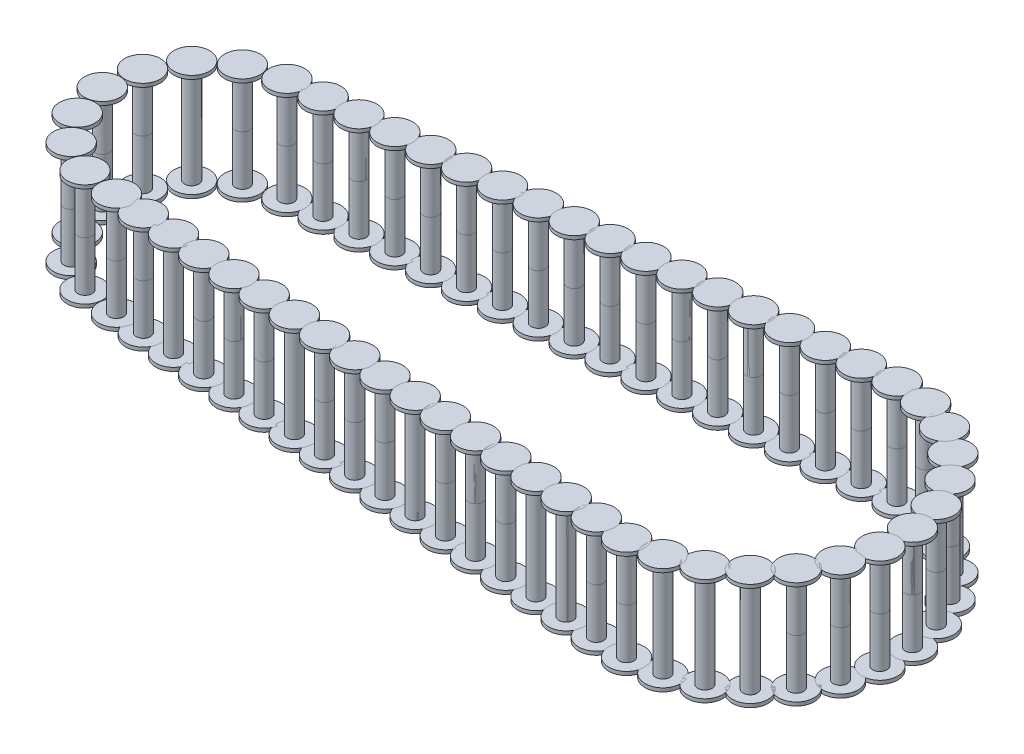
SolidWorks part; units mm, degrees
ref_plane "Front" through (0, 0, 0) normal (0, 0, 1) x (1, 0, 0)
ref_plane "Top" through (0, 0, 0) normal (0, 1, 0) x (1, 0, 0)
ref_plane "Right" through (0, 0, 0) normal (1, 0, 0) x (0, 0, -1)
sketch "Sketch1" plane through (0, 0, 0) normal (0, 1, 0) x (1, 0, 0)
  line L0 (-0.4575, -5.9825) -> (38.6537, -8.9738) construction
  line L1 (-0.4575, 5.9825) -> (38.6537, 8.9738) construction
  line L2 (-0.4957, 6.4811) -> (38.6155, 9.4723) construction
  line L3 (-0.4957, -6.4811) -> (38.6155, -9.4723) construction
  arc A0 (38.6537, -8.9738) -> (38.6537, 8.9738) centre (39.34, 0) ccw construction
  arc A1 (-0.4575, 5.9825) -> (-0.4575, -5.9825) centre (0, 0) ccw construction
  arc A2 (38.6155, -9.4723) -> (38.6155, 9.4723) centre (39.34, 0) ccw construction
  arc A3 (-0.4957, 6.4811) -> (-0.4957, -6.4811) centre (0, 0) ccw construction
  circle A4 centre (39.34, 9.5) radius 0.5
  circle A5 centre (-0.4957, 6.4811) radius 0.5
  circle A6 centre (-2.9381, 5.798) radius 0.5
  circle A7 centre (-4.9333, 4.2323) radius 0.5
  circle A8 centre (-6.1774, 2.0223) radius 0.5
  circle A9 centre (-6.4811, -0.4957) radius 0.5
  circle A10 centre (-5.798, -2.9381) radius 0.5
  circle A11 centre (-4.2323, -4.9333) radius 0.5
  circle A12 centre (-2.0223, -6.1774) radius 0.5
  circle A13 centre (0.4957, -6.4811) radius 0.5
  circle A14 centre (41.6135, 9.2239) radius 0.5
  circle A15 centre (43.7549, 8.4118) radius 0.5
  circle A16 centre (45.6397, 7.1109) radius 0.5
  circle A17 centre (47.1583, 5.3966) radius 0.5
  circle A18 centre (48.2227, 3.3687) radius 0.5
  circle A19 centre (48.7707, 1.1451) radius 0.5
  circle A20 centre (48.7707, -1.1451) radius 0.5
  circle A21 centre (48.2227, -3.3687) radius 0.5
  circle A22 centre (47.1583, -5.3966) radius 0.5
  circle A23 centre (45.6397, -7.1109) radius 0.5
  circle A24 centre (43.7549, -8.4118) radius 0.5
  circle A25 centre (41.6135, -9.2239) radius 0.5
  circle A26 centre (39.34, -9.5) radius 0.5
  circle A27 centre (36.9966, 9.3238) radius 0.5
  circle A28 centre (34.6532, 9.1476) radius 0.5
  circle A29 centre (32.3098, 8.9714) radius 0.5
  circle A30 centre (29.9665, 8.7952) radius 0.5
  circle A31 centre (27.6231, 8.619) radius 0.5
  circle A32 centre (25.2797, 8.4428) radius 0.5
  circle A33 centre (22.9363, 8.2666) radius 0.5
  circle A34 centre (20.5929, 8.0904) radius 0.5
  circle A35 centre (18.2495, 7.9142) radius 0.5
  circle A36 centre (15.9061, 7.738) radius 0.5
  circle A37 centre (13.5628, 7.5618) radius 0.5
  circle A38 centre (11.2194, 7.3856) radius 0.5
  circle A39 centre (8.876, 7.2094) radius 0.5
  circle A40 centre (6.5326, 7.0332) radius 0.5
  circle A41 centre (4.1892, 6.857) radius 0.5
  circle A42 centre (1.8458, 6.6808) radius 0.5
  circle A43 centre (37.0465, -9.3275) radius 0.5
  circle A44 centre (34.7529, -9.1551) radius 0.5
  circle A45 centre (32.4594, -8.9826) radius 0.5
  circle A46 centre (30.1659, -8.8102) radius 0.5
  circle A47 centre (27.8724, -8.6377) radius 0.5
  circle A48 centre (25.5788, -8.4653) radius 0.5
  circle A49 centre (23.2853, -8.2928) radius 0.5
  circle A50 centre (20.9918, -8.1204) radius 0.5
  circle A51 centre (18.6983, -7.9479) radius 0.5
  circle A52 centre (16.4047, -7.7755) radius 0.5
  circle A53 centre (14.1112, -7.603) radius 0.5
  circle A54 centre (11.8177, -7.4306) radius 0.5
  circle A55 centre (9.5242, -7.2581) radius 0.5
  circle A56 centre (7.2306, -7.0857) radius 0.5
  circle A57 centre (4.9371, -6.9132) radius 0.5
  circle A58 centre (2.6436, -6.7408) radius 0.5
  dimension "D1" = 18
  dimension "D2" = 12
  dimension "D3" = 39.34
  dimension "D4" = 0.5
extrude "Extrude1" add sketch "Sketch1" along normal blind 3.5
sketch "Sketch2" plane through (0, 3.5, 0) normal (0, 1, 0) x (-1, 0, 0)
  circle A0 centre (4.9333, -4.2323) radius 1.2514
extrude "Extrude2" add sketch "Sketch2" along normal blind 0.25
sketch "Sketch3" plane through (0, 3.5, 0) normal (0, 1, 0) x (-1, 0, 0)
  point P0 (2.9381, -5.798)
  point P1 (0.4957, -6.4811)
  point P3 (-1.8458, -6.6808)
  point P5 (-4.1892, -6.857)
  point P7 (-6.5326, -7.0332)
  point P9 (-8.876, -7.2094)
  point P11 (-11.2194, -7.3856)
  point P13 (-13.5628, -7.5618)
  point P15 (-15.9061, -7.738)
  point P17 (-18.2495, -7.9142)
  point P19 (-20.5929, -8.0904)
  point P21 (-22.9363, -8.2666)
  point P23 (-25.2797, -8.4428)
  point P25 (-27.6231, -8.619)
  point P27 (-29.9665, -8.7952)
  point P29 (-32.3098, -8.9714)
  point P31 (-34.6532, -9.1476)
  point P33 (-36.9966, -9.3238)
  point P35 (-39.34, -9.5)
  point P37 (-41.6135, -9.2239)
  point P39 (-43.7549, -8.4118)
  point P41 (-45.6397, -7.1109)
  point P43 (-47.1583, -5.3966)
  point P45 (-48.2227, -3.3687)
  point P47 (-48.7707, -1.1451)
  point P49 (-48.7707, 1.1451)
  point P51 (-48.2227, 3.3687)
  point P53 (-47.1583, 5.3966)
  point P55 (-45.6397, 7.1109)
  point P57 (-43.7549, 8.4118)
  point P59 (-41.6135, 9.2239)
  point P61 (-39.34, 9.5)
  point P63 (-37.0465, 9.3275)
  point P65 (-34.7529, 9.1551)
  point P67 (-32.4594, 8.9826)
  point P69 (-30.1659, 8.8102)
  point P71 (-27.8724, 8.6377)
  point P73 (-25.5788, 8.4653)
  point P75 (-23.2853, 8.2928)
  point P77 (-20.9918, 8.1204)
  point P79 (-18.6983, 7.9479)
  point P81 (-16.4047, 7.7755)
  point P83 (-14.1112, 7.603)
  point P85 (-11.8177, 7.4306)
  point P87 (-9.5242, 7.2581)
  point P89 (-7.2306, 7.0857)
  point P91 (-4.9371, 6.9132)
  point P93 (-2.6436, 6.7408)
  point P95 (-0.4957, 6.4811)
  point P97 (2.0223, 6.1774)
  point P99 (4.2323, 4.9333)
  point P101 (5.798, 2.9381)
  point P103 (6.4811, 0.4957)
  point P105 (6.1774, -2.0223)
pattern_sketch "Sketch-Pattern2" of "Extrude2"
mirror "Mirror2"
